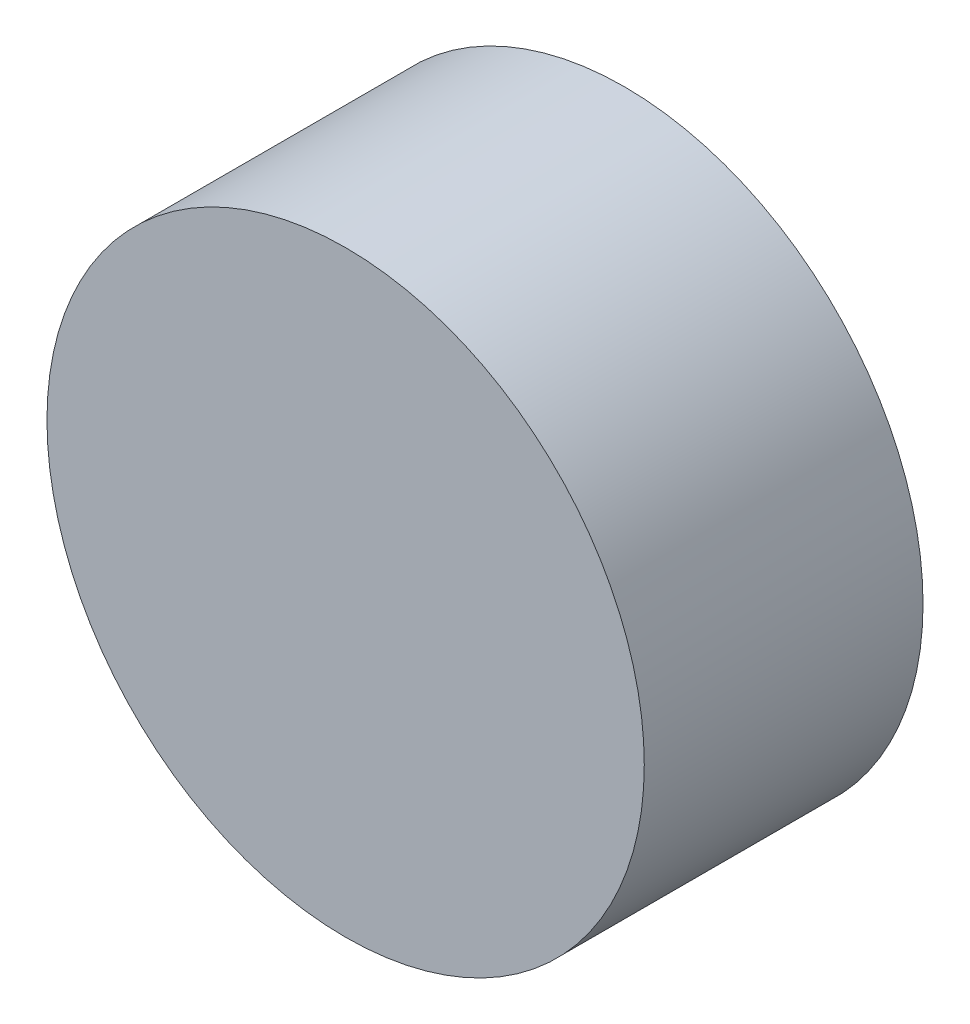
SolidWorks part; units mm, degrees
ref_plane "前视基准面" through (0, 0, 0) normal (0, 0, 1) x (1, 0, 0)
ref_plane "上视基准面" through (0, 0, 0) normal (0, 1, 0) x (1, 0, 0)
ref_plane "右视基准面" through (0, 0, 0) normal (1, 0, 0) x (0, 0, -1)
other "Configuration Table"
sketch "草图1" plane through (0, 0, 0) normal (0, 0, 1) x (1, 0, 0)
  circle A0 centre (0, 0) radius 30
extrude "Wheel_width28_PLACEHOLDER" add sketch "草图1" along normal blind 28
